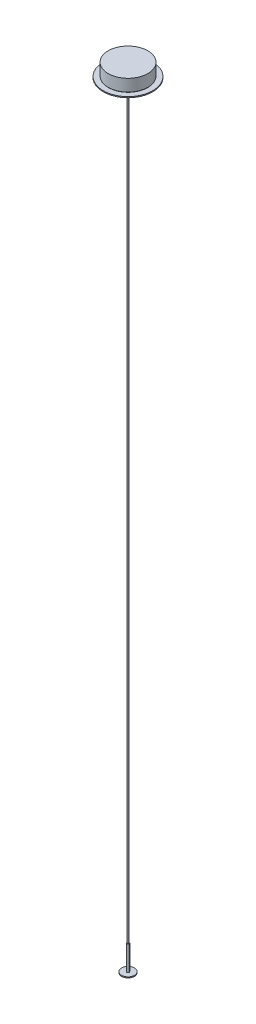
SolidWorks part; units mm, degrees
ref_plane "Alzado" through (0, 0, 0) normal (0, 0, 1) x (1, 0, 0)
ref_plane "Planta" through (0, 0, 0) normal (0, 1, 0) x (1, 0, 0)
ref_plane "Vista lateral" through (0, 0, 0) normal (1, 0, 0) x (0, 0, -1)
sketch "Croquis1" plane through (0, 0, 0) normal (0, 0, 1) x (1, 0, 0)
  line L0 (0, 0) -> (60, 0)
  line L2 (60, 0) -> (60, 80)
  dimension "D1" = 60
  dimension "D3" = 80
sketch "Croquis114" plane through (0, 0, 0) normal (0, 1, 0) x (0, 0, -1)
  circle A0 centre (0, 0) radius 40
  dimension "D1" = 80
extrude "Saliente-Extruir1" add sketch "Croquis114" along normal blind 25
fillet "Redondeo1" radius 1 1 edges at (0, 0, 40)
sketch "Croquis115" plane through (0, 0, 0) normal (0, -1, 0) x (0, 0, 1)
  circle A0 centre (0, 0) radius 50
extrude "Saliente-Extruir2" add sketch "Croquis115" along normal blind 2
sketch "Croquis122" plane through (0, -2, 0) normal (0, -1, 0) x (0, 0, 1)
  circle A0 centre (0, 0) radius 6
  dimension "D1" = 12
extrude "Saliente-Extruir3" add sketch "Croquis122" along normal blind 15 separate body
sketch "Croquis123" plane through (0, -17, 0) normal (0, -1, 0) x (0, 0, 1)
  circle A0 centre (0, 0) radius 1.5
  dimension "D1" = 3
extrude "Saliente-Extruir4" add sketch "Croquis123" along normal blind 1500 separate body
sketch "Croquis124" plane through (0, -1517, 0) normal (0, -1, 0) x (0, 0, 1)
  circle A0 centre (0, 0) radius 2.5
  dimension "D1" = 5
extrude "Saliente-Extruir5" add sketch "Croquis124" along normal blind 50 separate body
sketch "Croquis125" plane through (0, -1567, 0) normal (0, -1, 0) x (0, 0, 1)
  circle A0 centre (0, 0) radius 13
  dimension "D1" = 26
extrude "Saliente-Extruir6" add sketch "Croquis125" along normal blind 2
